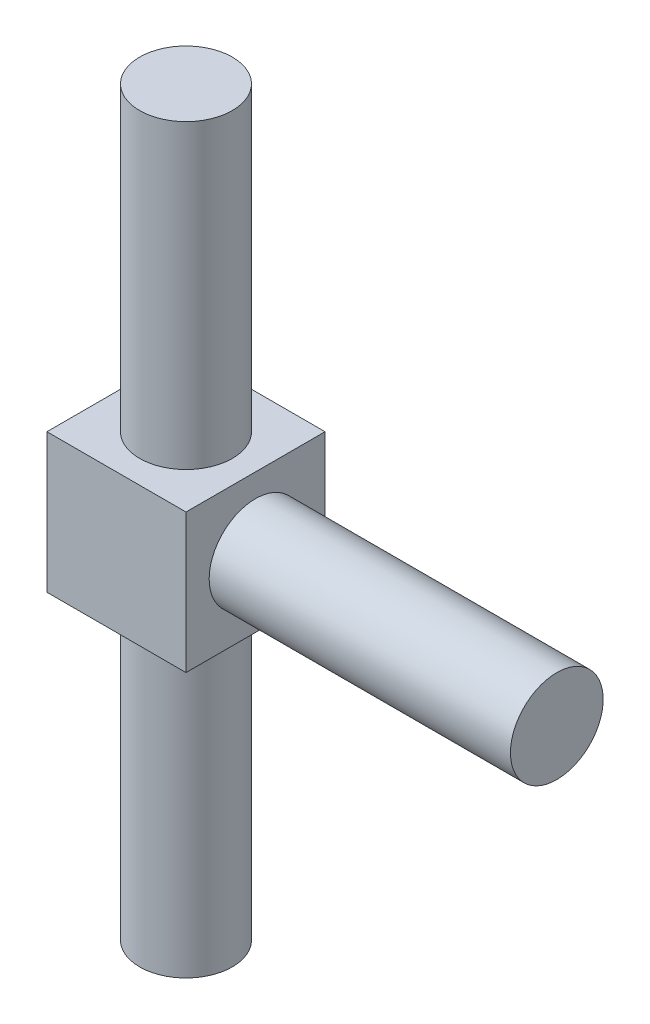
SolidWorks part; units mm, degrees
ref_plane "前视基准面" through (0, 0, 0) normal (0, 0, 1) x (1, 0, 0)
ref_plane "上视基准面" through (0, 0, 0) normal (0, 1, 0) x (1, 0, 0)
ref_plane "右视基准面" through (0, 0, 0) normal (1, 0, 0) x (0, 0, -1)
other "Configuration Table"
sketch "草图1" plane through (0, 0, 0) normal (0, 1, 0) x (1, 0, 0)
  line L1 (0, 0) -> (6, 0)
  line L2 (0, 0) -> (0, 6)
  line L3 (0, 6) -> (6, 6)
  line L4 (6, 0) -> (6, 6)
  dimension "D1" = 6
  dimension "D2" = 6
extrude "凸台-拉伸1" add sketch "草图1" along normal blind 6
sketch "草图2" plane through (0, 6, 0) normal (0, 1, 0) x (1, 0, 0)
  circle A0 centre (3, 3) radius 2
extrude "凸台-拉伸2" add sketch "草图2" along normal blind 13
sketch "草图3" plane through (0, 0, 0) normal (0, -1, 0) x (1, 0, 0)
  line L0 (0, -6) -> (6, 0)
  circle A0 centre (3, -3) radius 2
extrude "凸台-拉伸3" add sketch "草图3" along normal blind 13 contours L0 A0 | L0 A0
sketch "草图4" plane through (6, 0, 0) normal (1, 0, 0) x (0, 0, -1)
  line L0 (6, 6) -> (0, 0)
  circle A0 centre (3, 3) radius 2
extrude "凸台-拉伸4" add sketch "草图4" along normal blind 13 contours L0 A0 | L0 A0
